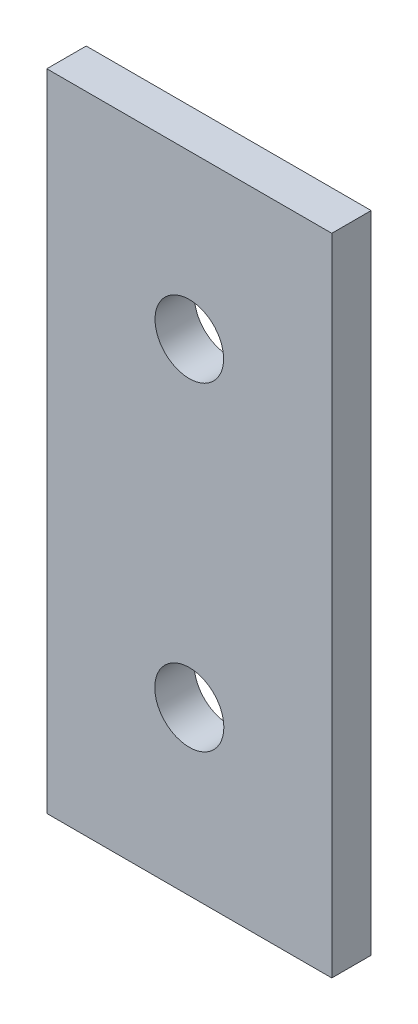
SolidWorks part; units mm, degrees
ref_plane "Front" through (0, 0, 0) normal (0, 0, 1) x (1, 0, 0)
ref_plane "Top" through (0, 0, 0) normal (0, 1, 0) x (1, 0, 0)
ref_plane "Right" through (0, 0, 0) normal (1, 0, 0) x (0, 0, -1)
sketch "Sketch1" plane through (0, 0, 0) normal (0, 0, 1) x (1, 0, 0)
  line L1 (-16.891, 38.227) -> (16.891, 38.227)
  line L2 (-16.891, 38.227) -> (-16.891, -38.227)
  line L3 (-16.891, -38.227) -> (16.891, -38.227)
  line L4 (16.891, 38.227) -> (16.891, -38.227)
  line L5 (-16.891, 38.227) -> (16.891, -38.227) construction
  line L6 (-16.891, -38.227) -> (16.891, 38.227) construction
  point P0 (0, 0)
  dimension "D1" = 33.782
  dimension "D2" = 76.454
extrude "Boss-Extrude1" add sketch "Sketch1" along normal blind 4.6711
sketch "Sketch2" plane through (0, 0, 4.6711) normal (0, 0, 1) x (1, 0, 0)
  circle A0 centre (0, 18.923) radius 4.064
  circle A1 centre (0, -18.8923) radius 4.0947
  dimension "D1" = 8.128
  dimension "D2" = 8.1895
extrude "Cut-Extrude1" cut sketch "Sketch2" against normal through all
